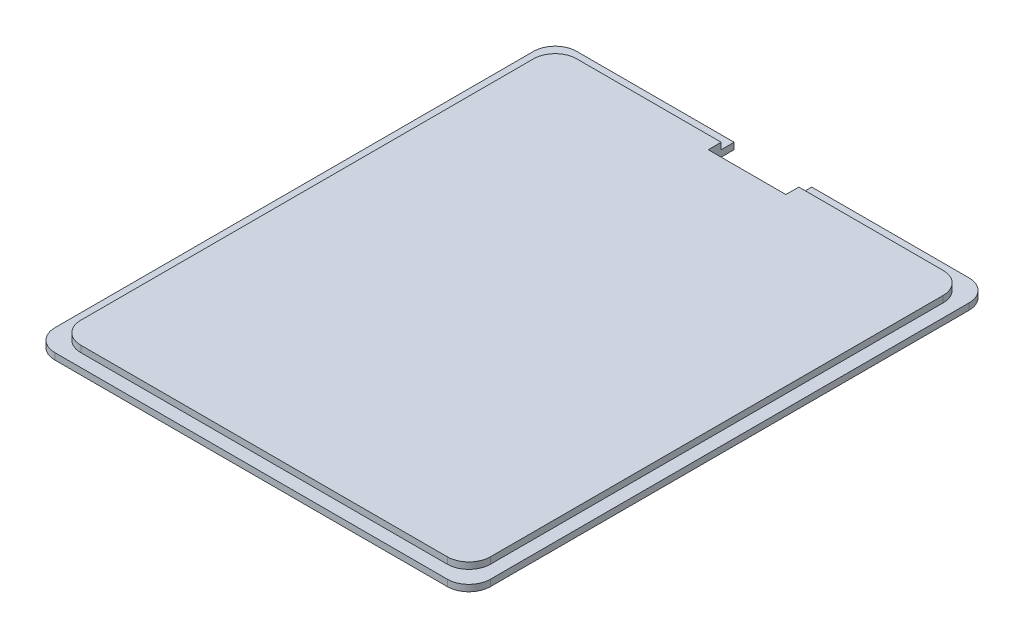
SolidWorks part; units mm, degrees
ref_plane "Plan de face" through (0, 0, 0) normal (0, 0, 1) x (1, 0, 0)
ref_plane "Plan de dessus" through (0, 0, 0) normal (0, 1, 0) x (1, 0, 0)
ref_plane "Plan de droite" through (0, 0, 0) normal (1, 0, 0) x (0, 0, -1)
sketch "Esquisse1" plane through (0, 0, 0) normal (0, 1, 0) x (1, 0, 0)
  line L0 (0, 0) -> (0, -17.3713) construction
  line L1 (-50.5, 60.5) -> (50.5, 60.5)
  line L2 (-50.5, 60.5) -> (-50.5, -60.5)
  line L3 (-50.5, -60.5) -> (50.5, -60.5)
  line L4 (50.5, 60.5) -> (50.5, -60.5)
  line L5 (0, 0) -> (26.7558, 0) construction
  dimension "D1" = 121
  dimension "D2" = 101
extrude "Boss.-Extru.1" add sketch "Esquisse1" along normal blind 1.5
sketch "Esquisse4" plane through (0, 1.5, 0) normal (0, 1, 0) x (1, 0, 0)
  line L8 (-47.5, 57.5) -> (-47.5, -57.5)
  line L9 (-47.5, -57.5) -> (47.5, -57.5)
  line L10 (47.5, -57.5) -> (47.5, 57.5)
  line L11 (47.5, 57.5) -> (-47.5, 57.5)
  line L12 (-47.5, 57.5) -> (-47.5, -57.5)
  line L13 (-47.5, -57.5) -> (47.5, -57.5)
  line L14 (47.5, -57.5) -> (47.5, 57.5)
  line L15 (47.5, 57.5) -> (-47.5, 57.5)
  dimension "D1" = 3
extrude "Boss.-Extru.3" add sketch "Esquisse4" along normal blind 1.5
fillet "Congé2" radius 5 8 edges at (-47.5, 2.25, -57.5) (-50.5, 0.75, -60.5) (47.5, 2.25, -57.5) (50.5, 0.75, -60.5) (47.5, 2.25, 57.5) (50.5, 0.75, 60.5) (-47.5, 2.25, 57.5) (-50.5, 0.75, 60.5)
sketch "Esquisse9" plane through (0, 0, 0) normal (0, -1, 0) x (1, 0, 0)
  line L0 (50.5, 13.2028) -> (-50.5, 13.2028) construction
  line L1 (50.5, 55.5) -> (50.5, -55.5) construction
  line L2 (-50.5, -55.5) -> (-50.5, 55.5) construction
  text T0 "<b>220V</b>  <b> </b>" font "Century Gothic" height 10
extrude "Enlèv. mat.-Extru.2" cut sketch "Esquisse9" against normal blind 1
sketch "Esquisse10" plane through (0, 0, 0) normal (0, -1, 0) x (1, 0, 0)
  line L0 (50.5, 35.5038) -> (-50.5, 35.5038) construction
  line L1 (50.5, 55.5) -> (50.5, -55.5) construction
  line L2 (-50.5, -55.5) -> (-50.5, 55.5) construction
  text T0 "<b>DO NOT TOUCH</b>" font "Century Gothic" height 8
extrude "Enlèv. mat.-Extru.3" cut sketch "Esquisse10" against normal blind 1
sketch "Esquisse11" plane through (0, 0, -60.5) normal (0, 0, -1) x (-1, 0, 0)
  line L0 (-45.5, 0) -> (45.5, 0) construction
  line L1 (-9.008, 0) -> (8.992, 0)
  line L2 (-9.008, 0) -> (-9.008, 8.1157)
  line L3 (-9.008, 8.1157) -> (8.992, 8.1157)
  line L4 (8.992, 0) -> (8.992, 8.1157)
  line L5 (-0.008, 0) -> (-0.008, 4.9921) construction
  dimension "D1" = 18
extrude "Enlèv. mat.-Extru.4" cut sketch "Esquisse11" against normal blind 6
